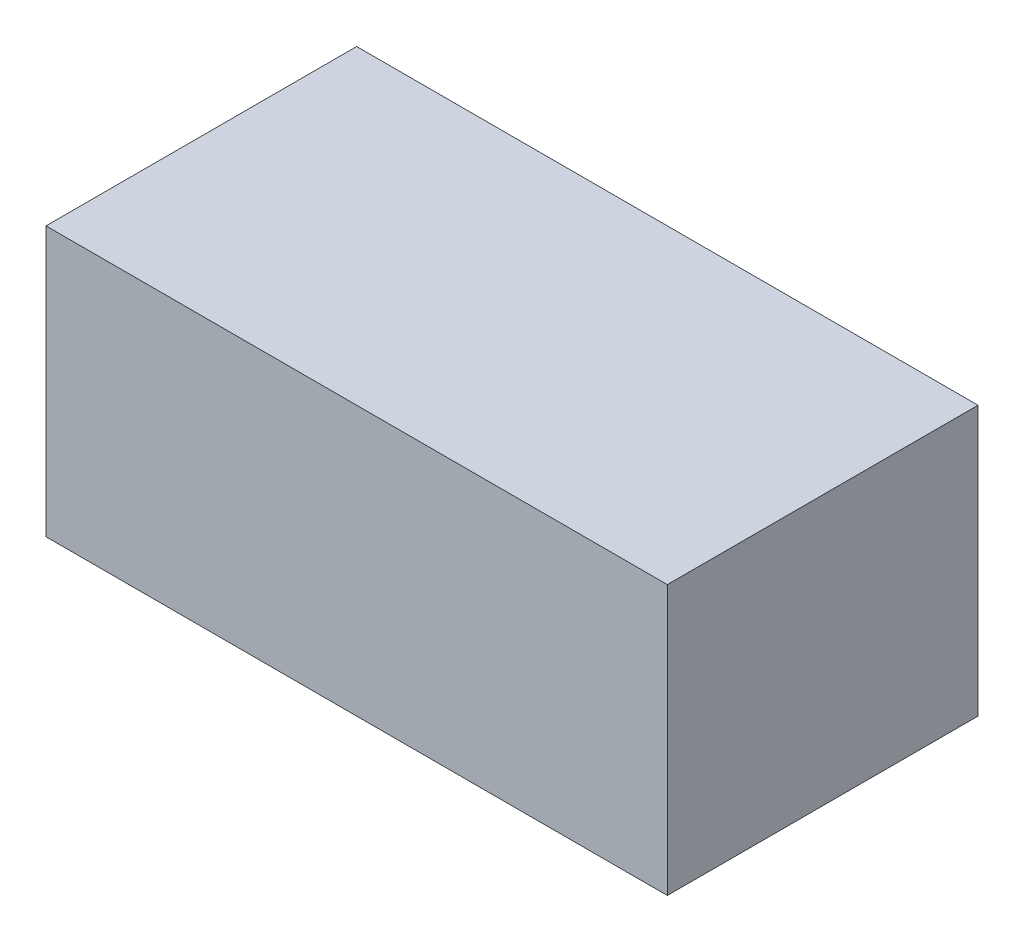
SolidWorks part; units mm, degrees
ref_plane "Front Plane" through (0, 0, 0) normal (0, 0, 1) x (1, 0, 0)
ref_plane "Top Plane" through (0, 0, 0) normal (0, 1, 0) x (1, 0, 0)
ref_plane "Right Plane" through (0, 0, 0) normal (1, 0, 0) x (0, 0, -1)
surface "Surface-Radiate1" parameters "D1"=40
surface "Surface-Knit1"
ref_plane "Plane1" through (0, 62.6063, 0) normal (0, 1, 0) x (1, 0, 0)
sketch "Sketch2" plane through (0, 62.6063, 0) normal (0, 1, 0) x (1, 0, 0)
  line L1 (-75, -37.5) -> (75, -37.5)
  line L2 (-75, -37.5) -> (-75, 37.5)
  line L3 (-75, 37.5) -> (75, 37.5)
  line L4 (75, -37.5) -> (75, 37.5)
  line L5 (-75, -37.5) -> (75, 37.5) construction
  line L6 (-75, 37.5) -> (75, -37.5) construction
  point P0 (0, 0)
  dimension "D1" = 150
  dimension "D2" = 75
extrude "Boss-Extrude1" add sketch "Sketch2" against normal up to surface (65 mm away)
